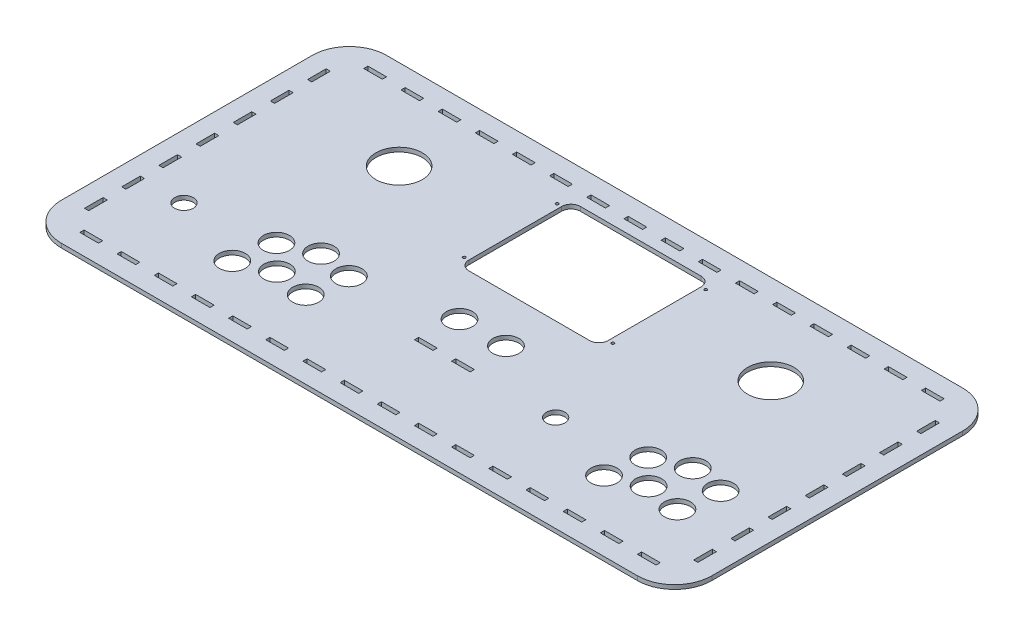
SolidWorks part; units mm, degrees
ref_plane "Front Plane" through (0, 0, 0) normal (0, 0, 1) x (1, 0, 0)
ref_plane "Top Plane" through (0, 0, 0) normal (0, 1, 0) x (1, 0, 0)
ref_plane "Right Plane" through (0, 0, 0) normal (1, 0, 0) x (0, 0, -1)
imported_body "Imported1"
sketch "Sketch1" plane through (0, 4.5, 0) normal (0, 1, 0) x (1, 0, 0)
  line L0 (128.3151, 230.8196) -> (128.3151, 110.8196) construction
  line L1 (193.3151, 230.8196) -> (63.3151, 230.8196) construction
  line L2 (63.3151, 110.8196) -> (193.3151, 110.8196) construction
  line L3 (53.3151, 170.8196) -> (203.3151, 170.8196) construction
  line L4 (53.3151, 220.8196) -> (53.3151, 120.8196) construction
  line L5 (203.3151, 120.8196) -> (203.3151, 220.8196) construction
  circle A0 centre (48.3151, 220.8196) radius 1.5
  circle A1 centre (208.3151, 220.8196) radius 1.5
  circle A2 centre (208.3151, 120.8196) radius 1.5
  circle A3 centre (48.3151, 120.8196) radius 1.5
  dimension "D1" = 3
  dimension "D2" = 160
  dimension "D3" = 100
extrude "Cut-Extrude1" cut sketch "Sketch1" against normal up to next
